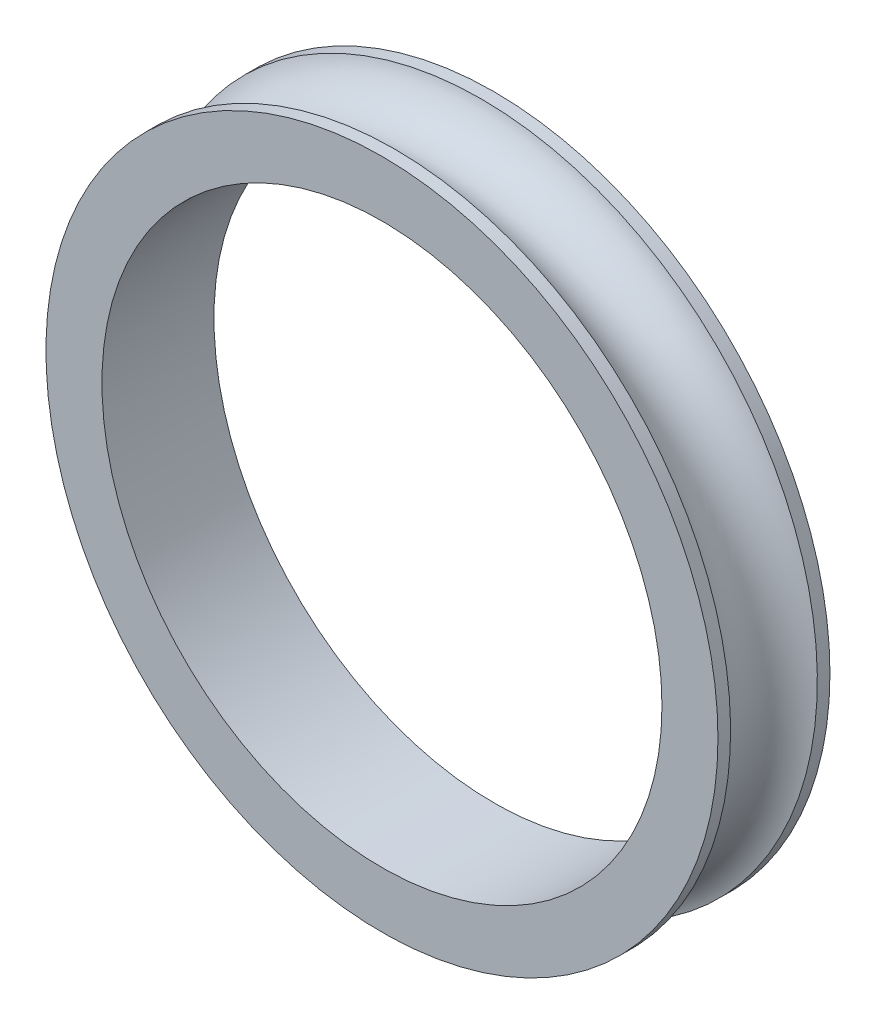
SolidWorks part; units mm, degrees
ref_plane "Спереди" through (0, 0, 0) normal (0, 0, 1) x (1, 0, 0)
ref_plane "Сверху" through (0, 0, 0) normal (0, 1, 0) x (1, 0, 0)
ref_plane "Справа" through (0, 0, 0) normal (1, 0, 0) x (0, 0, -1)
sketch "Эскиз1" plane through (0, 0, 0) normal (0, 0, 1) x (1, 0, 0)
  circle A1 centre (0, 0) radius 30
sketch "Эскиз2" plane through (0, 0, 0) normal (0, 0, 1) x (1, 0, 0)
  circle A0 centre (0, 0) radius 25
extrude "Бобышка-Вытянуть2" add sketch "Эскиз1" along normal blind 10
extrude "Вырез-Вытянуть5" cut sketch "Эскиз2" along normal blind 10
sketch "Эскиз4" plane through (0, 0, 0) normal (1, 0, 0) x (0, 0, -1)
  line L0 (-1.127, -30) -> (-8.873, -30)
  line L3 (0, 0) -> (-14.9502, 0) construction
  arc A0 (-1.127, -30) -> (-8.873, -30) centre (-5, -31) ccw
revolve "Вырез-Повернуть2" cut sketch "Эскиз4" angle 360 about L3
